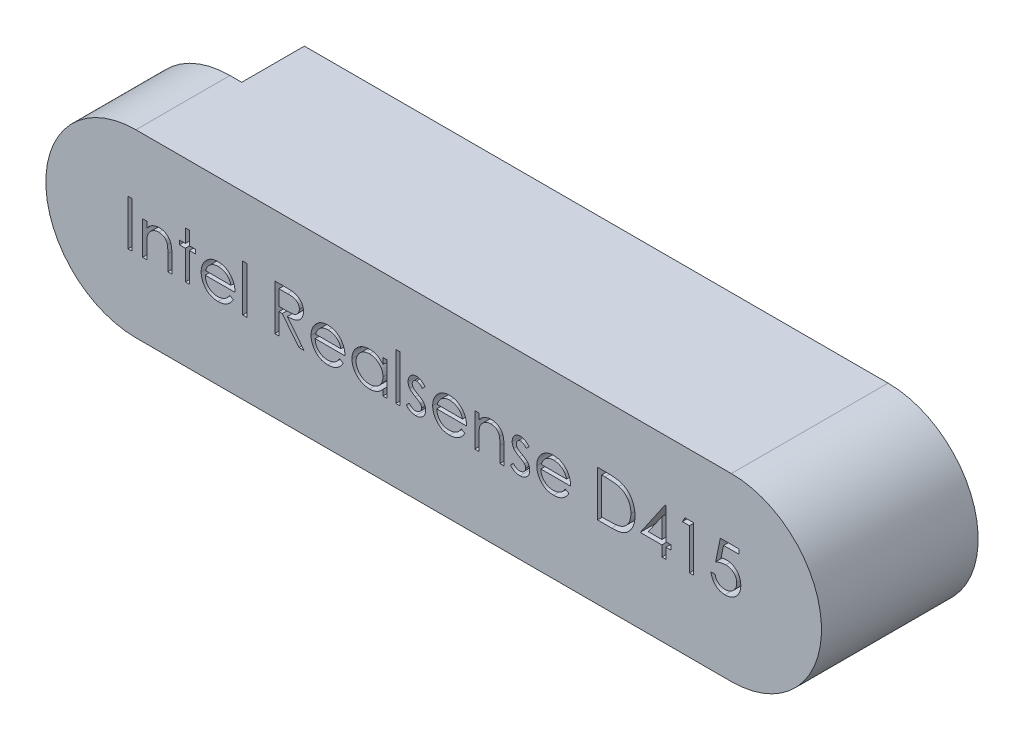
SolidWorks part; units mm, degrees
ref_plane "Front Plane" through (0, 0, 0) normal (0, 0, 1) x (1, 0, 0)
ref_plane "Top Plane" through (0, 0, 0) normal (0, 1, 0) x (1, 0, 0)
ref_plane "Right Plane" through (0, 0, 0) normal (1, 0, 0) x (0, 0, -1)
sketch "Sketch1" plane through (0, 0, 0) normal (0, 0, 1) x (1, 0, 0)
  line L1 (38, -11.5) -> (-38, -11.5)
  line L3 (38, 11.5) -> (-38, 11.5)
  line L5 (38, -11.5) -> (-38, 11.5) construction
  line L6 (38, 11.5) -> (-38, -11.5) construction
  arc A0 (-38, 11.5) -> (-38, -11.5) centre (-38, 0) ccw
  arc A1 (38, -11.5) -> (38, 11.5) centre (38, 0) ccw
  point P0 (0, 0)
  point P7 (-49.5, 0)
  point P8 (49.5, 0)
  dimension "D1" = 23
  dimension "D2" = 99
extrude "Boss-Extrude1" add sketch "Sketch1" along normal mid plane 20
sketch "Sketch3" plane through (0, 0, 10) normal (0, 0, 1) x (1, 0, 0)
  text T0 "Intel Realsense D415" font "Century Gothic" height in points 22
extrude "Cut-Extrude1" cut sketch "Sketch3" against normal blind 5
sketch "Sketch5" plane through (0, -11.5, 0) normal (0, -1, 0) x (1, 0, 0)
  circle A0 centre (0, 0) radius 2.5
  dimension "D1" = 5
extrude "Cut-Extrude2" cut sketch "Sketch5" against normal blind 10
ref_plane "Plane2" through (-49.5, 0, 0) normal (1, 0, 0) x (0, 0, -1)
sketch "Sketch6" plane through (-49.5, 0, 0) normal (1, 0, 0) x (0, 0, -1)
  line L0 (-10, -11.5) -> (10, -11.5) construction
  line L1 (2, -11.5) -> (10, -11.5)
  line L2 (2, -11.5) -> (2, 11.5)
  line L3 (2, 11.5) -> (10, 11.5)
  line L4 (10, -11.5) -> (10, 11.5)
  line L5 (-10, 11.5) -> (-10, -11.5) construction
  dimension "D1" = 12
extrude "Cut-Extrude3" cut sketch "Sketch6" along normal blind 13
sketch "Sketch7" plane through (-36.5, 0, 0) normal (-1, 0, 0) x (0, 0, 1)
  line L0 (-10, 0) -> (10, 0) construction
  line L2 (-7.28, 3.315) -> (-7.28, -3.315)
  line L4 (-4.72, 3.315) -> (-4.72, -3.315)
  line L5 (-10, -11.5) -> (-10, 11.5) construction
  line L6 (10, -11.5) -> (10, 11.5) construction
  line L7 (-6, -3.315) -> (-6, 3.315) construction
  line L8 (-10, 3.315) -> (-2, 3.315) construction
  line L9 (-2, 11.5) -> (-2, -11.5) construction
  arc A0 (-4.72, 3.315) -> (-7.28, 3.315) centre (-6, 3.315) ccw
  arc A1 (-7.28, -3.315) -> (-4.72, -3.315) centre (-6, -3.315) ccw
  point P9 (-6, 3.315)
  point P13 (-7.28, 0)
  dimension "D1" = 2.56
  dimension "D2" = 6.63
extrude "Cut-Extrude4" cut sketch "Sketch7" against normal blind 5
